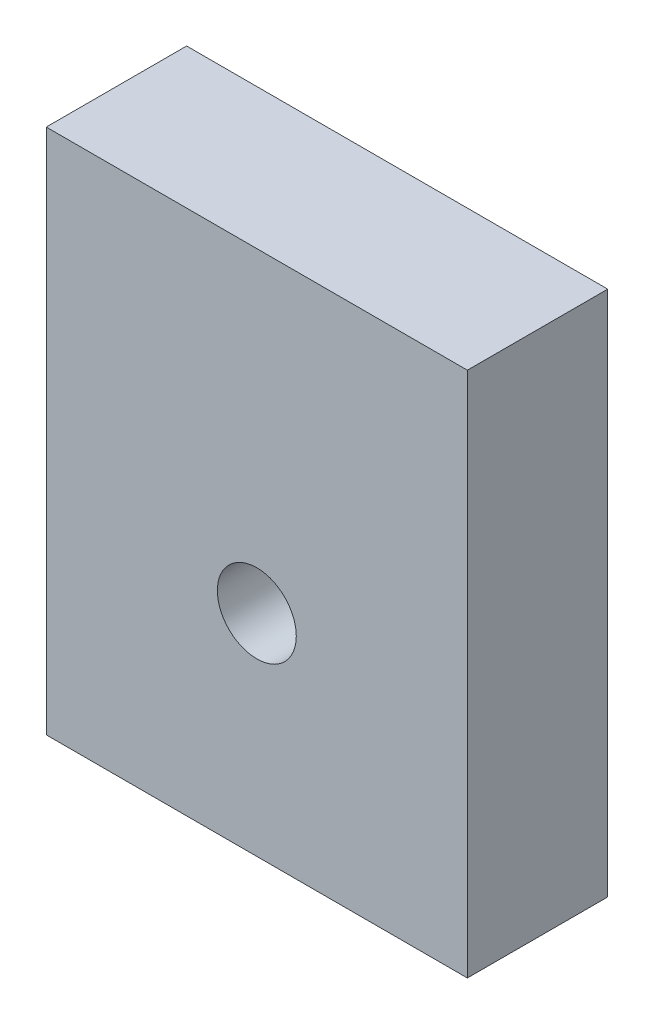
SolidWorks part; units mm, degrees
ref_plane "Front Plane" through (0, 0, 0) normal (0, 0, 1) x (1, 0, 0)
ref_plane "Top Plane" through (0, 0, 0) normal (0, 1, 0) x (1, 0, 0)
ref_plane "Right Plane" through (0, 0, 0) normal (1, 0, 0) x (0, 0, -1)
sketch "Sketch1" plane through (0, 0, 0) normal (0, 1, 0) x (1, 0, 0)
  line L1 (-59.8982, 13.9305) -> (92.5018, 13.9305)
  line L2 (-59.8982, 13.9305) -> (-59.8982, -36.8695)
  line L3 (-59.8982, -36.8695) -> (92.5018, -36.8695)
  line L4 (92.5018, 13.9305) -> (92.5018, -36.8695)
  dimension "D1" = 152.4
  dimension "D2" = 50.8
extrude "Boss-Extrude1" add sketch "Sketch1" along normal blind 190.5
hole_wizard "3/4 (0.75) Diameter Slot1" positions "Sketch3" profile "Sketch2" size "3/4" standard "ANSI Inch"
sketch "Sketch3" plane through (0, 0, 36.8695) normal (0, 0, 1) x (1, 0, 0)
  line L0 (92.5018, 190.5) -> (92.5018, 0) construction
  line L1 (-59.8982, 0) -> (92.5018, 0) construction
  point P0 (16.3018, 76.2)
  dimension "D1" = 76.2
  dimension "D2" = 76.2
sketch "Sketch2" plane through (16.3018, 76.2, 36.8695) normal (1, 0, 0) x (0, -1, 0)
  line L0 (0, 0) -> (0, 50.8)
  line L1 (0, 50.8) -> (14.2875, 50.8)
  line L2 (14.2875, 50.8) -> (14.2875, 0)
  line L5 (14.2875, 0) -> (0, 0)
  line L11 (0, -6.35) -> (0, 107.95) construction
  dimension "Thru Hole Dia." = 28.575
  dimension "Thru Hole Depth" = 50.8
